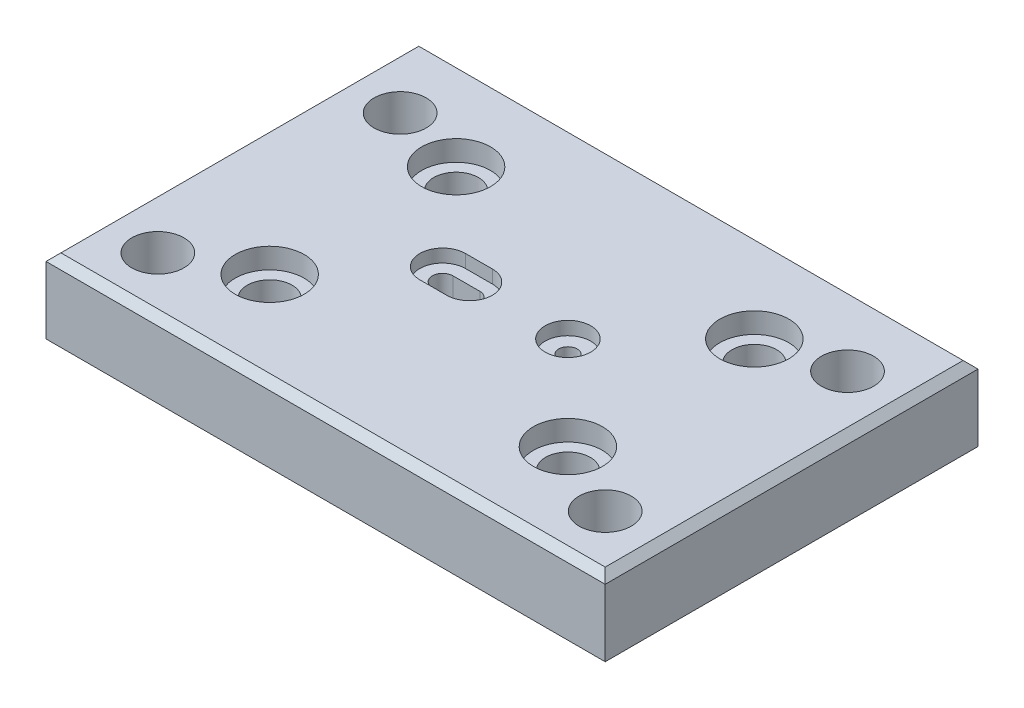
SolidWorks part; units mm, degrees
ref_plane "Front" through (0, 0, 0) normal (0, 0, 1) x (1, 0, 0)
ref_plane "Top" through (0, 0, 0) normal (0, 1, 0) x (1, 0, 0)
ref_plane "Right" through (0, 0, 0) normal (1, 0, 0) x (0, 0, -1)
sketch "Sketch1" plane through (0, 0, 0) normal (0, 1, 0) x (1, 0, 0)
  line L0 (75, -50) -> (-75, 50) construction
  line L1 (-75, 50) -> (75, 50)
  line L2 (-75, 50) -> (-75, -50)
  line L3 (-75, -50) -> (75, -50)
  line L4 (75, 50) -> (75, -50)
  dimension "D1" = 150
  dimension "D2" = 100
extrude "Extrude1" add sketch "Sketch1" along normal blind 20
chamfer "Chamfer1" distance 2 angle 45 4 edges at (-75, 20, 0) (0, 20, -50) (75, 20, 0) (0, 20, 50)
hole_wizard "CBORE for M10 SBHCS1" positions "Sketch4" profile "Sketch3" counterbore size "M10" standard "Ansi Metric"
sketch "Sketch4" plane through (0, 20, 0) normal (0, 1, 0) x (-1, 0, 0)
  line L0 (-75, 50) -> (75, 50) construction
  line L2 (75, 50) -> (75, -50) construction
  point P0 (40, 25)
  dimension "D1" = 25
  dimension "D2" = 35
sketch "Sketch3" plane through (-40, 20, 25) normal (1, 0, 0) x (0, 0, 1)
  line L0 (0, 0) -> (0, 20)
  line L1 (0, 20) -> (6, 20)
  line L3 (6, 20) -> (6, 5.5)
  line L4 (6, 5.5) -> (9.25, 5.5)
  line L5 (9.25, 5.5) -> (9.25, 0)
  line L7 (9.25, 0) -> (0, 0)
  line L11 (0, -6.35) -> (0, 107.95) construction
  dimension "Thru Hole Dia." = 12
  dimension "Thru Hole Depth" = 20
  dimension "C'Bore Dia." = 18.5
  dimension "C'Bore Depth" = 5.5
pattern_linear "LPattern2" count 2 spacing 80 along (1, 0, 0) count 2 spacing 50 along (0, 0, -1) of "CBORE for M10 SBHCS1"
hole_wizard "M16x2.0 Tapped Hole1" positions "Sketch8" profile "Sketch7" tap size "M16x2.0" standard "Ansi Metric"
sketch "Sketch8" plane through (0, 20, 0) normal (0, 1, 0) x (-1, 0, 0)
  line L0 (75, 50) -> (75, -50) construction
  line L1 (-75, 50) -> (75, 50) construction
  point P0 (60, 35)
  dimension "D1" = 15
  dimension "D2" = 15
sketch "Sketch7" plane through (-60, 20, 35) normal (1, 0, 0) x (0, 0, 1)
  line L0 (0, 0) -> (0, 20)
  line L1 (0, 20) -> (7, 20)
  line L2 (7, 20) -> (7, 0)
  line L5 (7, 0) -> (0, 0)
  line L11 (0, -6.35) -> (0, 107.95) construction
  dimension "Thru Tap Drill Dia." = 14
  dimension "Thru Tap Drill Depth" = 20
pattern_linear "LPattern3" count 2 spacing 65 along (0, 0, -1) count 2 spacing 120 along (1, 0, 0) of "M16x2.0 Tapped Hole1"
hole_wizard "CBORE SLOT for M5 Hex Head Bolt2" positions "Sketch13" profile "Sketch11" size "M5" standard "ISO"
sketch "Sketch13" plane through (0, 20, 0) normal (0, 1, 0) x (1, 0, 0)
  line L2 (-21.35, -0.0191) -> (-8.65, 0.0191) construction
  line L3 (0, 0) -> (-15, 0) construction
  line L5 (-75, -50) -> (-75, 50) construction
  point P15 (-15, 0)
  dimension "D1" = 60
  dimension "D2" = 12.7
sketch "Sketch11" plane through (-15, 20, 0) normal (1, 0, 0) x (0, 0, 1)
  line L0 (0, 0) -> (0, 26.6524)
  line L1 (0, 26.6524) -> (2.75, 25)
  line L2 (2.75, 25) -> (2.75, 3.5)
  line L3 (2.75, 3.5) -> (6.119, 3.5)
  line L4 (6.119, 3.5) -> (6.119, 0)
  line L5 (6.119, 0) -> (0, 0)
  line L10 (0, 26.6524) -> (-2.75, 25) construction
  line L11 (0, -6.35) -> (0, 107.95) construction
  dimension "Hole Dia." = 5.5
  dimension "Hole Depth" = 25
  dimension "C'Bore Dia." = 12.238
  dimension "C'Bore Depth" = 3.5
  dimension "Drill Angle" = 118
other "AdvancedHole1" parameters "D0"=0, "D3"=0, "D12"=3.97, "D18"=0, "D16"=0
sketch "Sketch14" plane through (0, 20, 0) normal (0, 1, 0) x (1, 0, 0)
  line L0 (0, 0) -> (15, 0) construction
  line L2 (75, 50) -> (75, -50) construction
  point P0 (15, 0)
  dimension "D1" = 60
sketch "Sketch15" plane through (15, 20, 0) normal (0, 0, -1) x (1, 0, 0)
  line L0 (0, 0) -> (0, 20)
  line L1 (0, -0.3556) -> (0, 1.0668) construction
  line L2 (6.12, 0) -> (6.12, 3.58)
  line L3 (0, 0) -> (6.12, 0)
  line L4 (6.12, 12.55) -> (6.12, 8.58)
  line L5 (2.75, 20) -> (5.2, 17.55)
  line L6 (2.5, 3.58) -> (2.5, 8.58)
  line L7 (6.12, 3.58) -> (2.5, 3.58)
  line L8 (6.12, 8.58) -> (2.5, 8.58)
  line L9 (-2.75, 20) -> (-5.2, 17.55) construction
  line L10 (0, 20) -> (2.75, 20)
  line L12 (2.5, 17.55) -> (2.5, 12.55)
  line L13 (5.2, 17.55) -> (2.5, 17.55)
  line L14 (2.5, 12.55) -> (6.12, 12.55)
  dimension "D1" = 3.58
  dimension "D2" = 12.24
  dimension "D3" = 3.97
  dimension "D5" = 5
  dimension "D6" = 5
  dimension "D7" = 2.45
  dimension "D8" = 10.4
  dimension "D10" = 90
  dimension "D11" = 5
  dimension "D13" = 5
  dimension "D14" = 12.24
